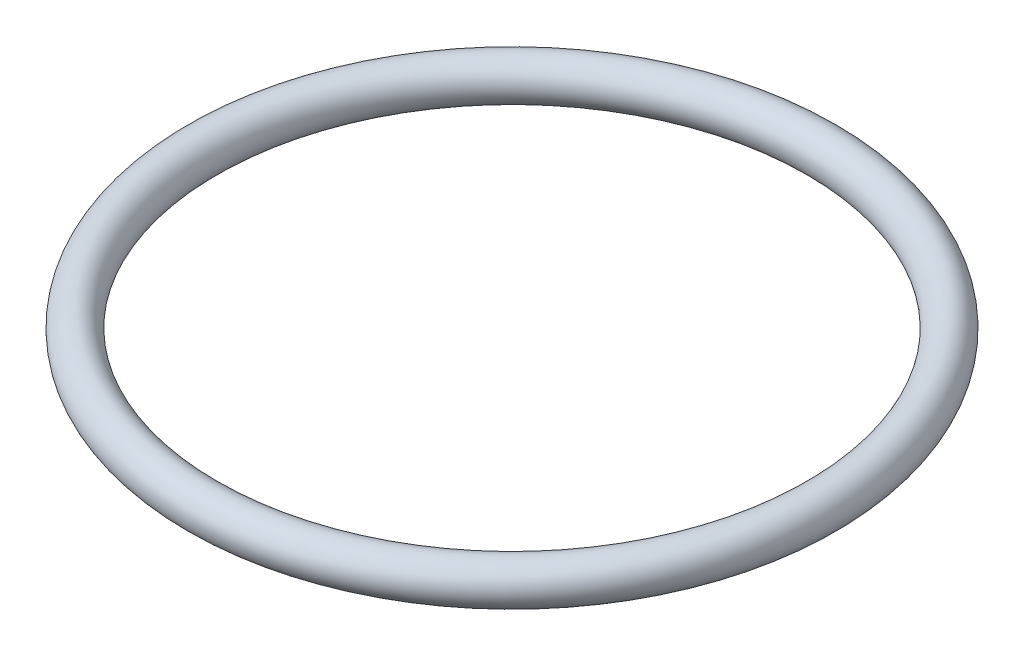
SolidWorks part; units mm, degrees
ref_plane "Face" through (0, 0, 0) normal (0, 0, 1) x (1, 0, 0)
ref_plane "Dessus" through (0, 0, 0) normal (0, 1, 0) x (1, 0, 0)
ref_plane "Droite" through (0, 0, 0) normal (1, 0, 0) x (0, 0, -1)
sketch "Esquisse1" plane through (0, 0, 0) normal (0, 0, 1) x (1, 0, 0)
  line L0 (0, 0) -> (0, -5.8877) construction
  circle A0 centre (-13.45, -0.64) radius 0.89
  dimension "D1" = 1.78
  dimension "D2" = 25.12
revolve "Révolution1" add sketch "Esquisse1" angle 360 about L0
